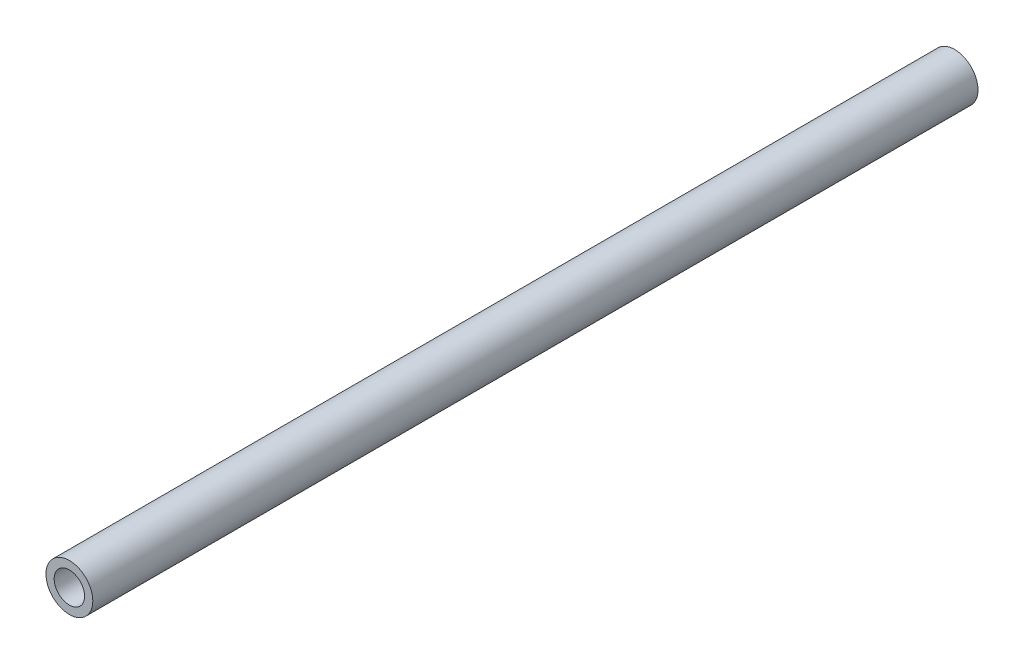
SolidWorks part; units mm, degrees
ref_plane "Спереди" through (0, 0, 0) normal (0, 0, 1) x (1, 0, 0)
ref_plane "Сверху" through (0, 0, 0) normal (0, 1, 0) x (1, 0, 0)
ref_plane "Справа" through (0, 0, 0) normal (1, 0, 0) x (0, 0, -1)
sketch "Эскиз1" plane through (0, 0, 0) normal (0, 0, 1) x (1, 0, 0)
  circle A0 centre (0, 0) radius 3.25
  circle A1 centre (0, 0) radius 5
  dimension "D1" = 6.5
  dimension "D2" = 10
extrude "Бобышка-Вытянуть1" add sketch "Эскиз1" along normal blind 189
